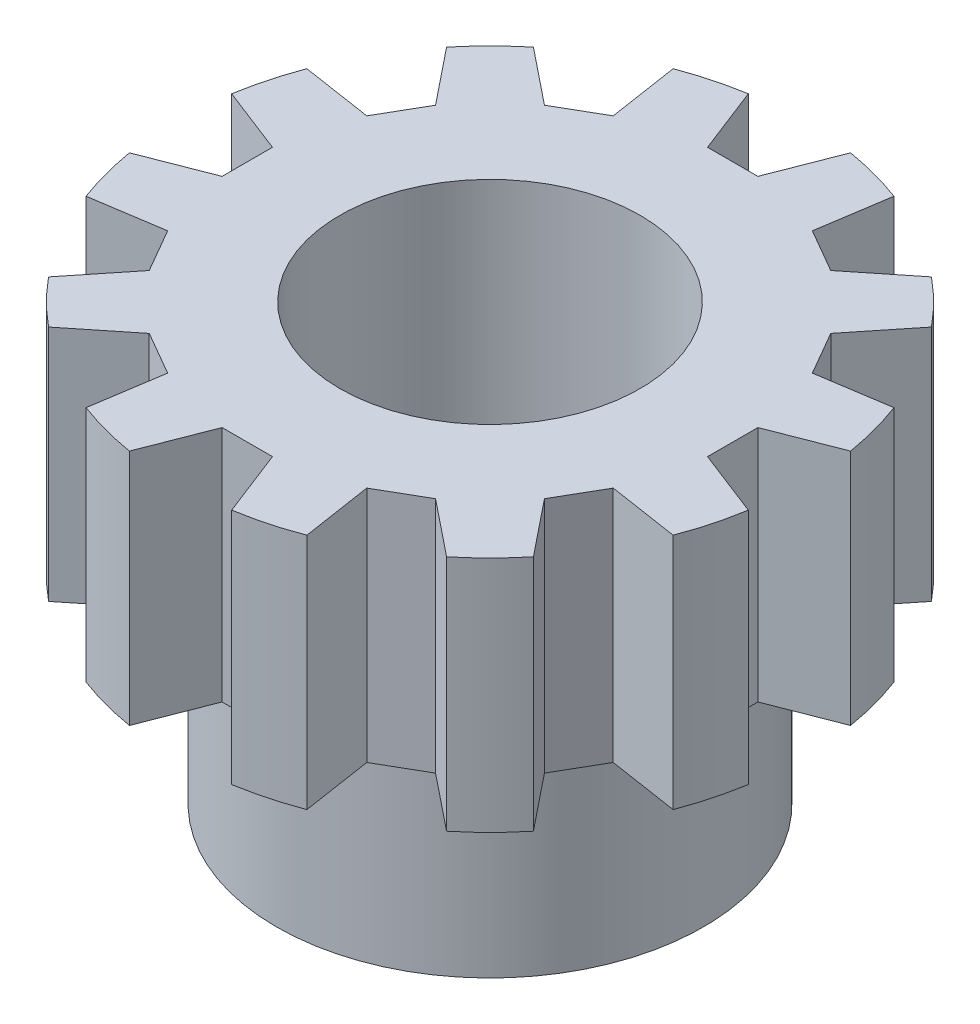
SolidWorks part; units mm, degrees
ref_plane "Front Plane" through (0, 0, 0) normal (0, 0, 1) x (1, 0, 0)
ref_plane "Top Plane" through (0, 0, 0) normal (0, 1, 0) x (1, 0, 0)
ref_plane "Right Plane" through (0, 0, 0) normal (1, 0, 0) x (0, 0, -1)
sketch "Sketch1" plane through (0, 0, 0) normal (0, 0, 1) x (1, 0, 0)
  line L1 (3.937, 47.625) -> (3.937, 55.8941)
  line L3 (6.7945, 45.4025) -> (6.7945, 77.6941) construction
  line L5 (2.7305, 51.3715) -> (0.8255, 51.3715)
  line L6 (0.8255, 51.3715) -> (0.8255, 55.8941)
  line L7 (0.8255, 55.8941) -> (3.937, 55.8941)
  line L8 (2.7305, 51.3715) -> (2.7305, 47.625)
  line L11 (3.937, 47.625) -> (2.7305, 47.625)
  dimension "D1" = 5.969
  dimension "D2" = 3.7465
  dimension "D3" = 8.2691
  dimension "D5" = 4.064
  dimension "D6" = 6.7945
revolve "Revolve1" add sketch "Sketch1" angle 360 about L3
sketch "Sketch2" plane through (-1.5196, 55.8941, 0) normal (0, 1, 0) x (-1, 0, 0)
  line L0 (-3.695, 0) -> (-1.5196, 0) construction
  line L1 (-3.695, 0.4791) -> (-2.425, 0.9732)
  line L2 (-3.695, -0.4791) -> (-2.425, -0.9732)
  line L5 (-3.695, 0.4791) -> (-3.695, -0.4791)
  circle A0 centre (-8.3141, 0) radius 5.969 construction
  arc A2 (-2.425, -0.9732) -> (-2.425, 0.9732) centre (-8.3141, 0) ccw
  dimension "D1" = 0.9582
  dimension "D2" = 1.9464
  dimension "D3" = 1.27
extrude "Cut-Extrude2" cut sketch "Sketch2" against normal up to next
pattern_circular "CirPattern1" count 12 over 360 about axis through (6.7945, 0, 0) along (0, 1, 0) of "Cut-Extrude2"
